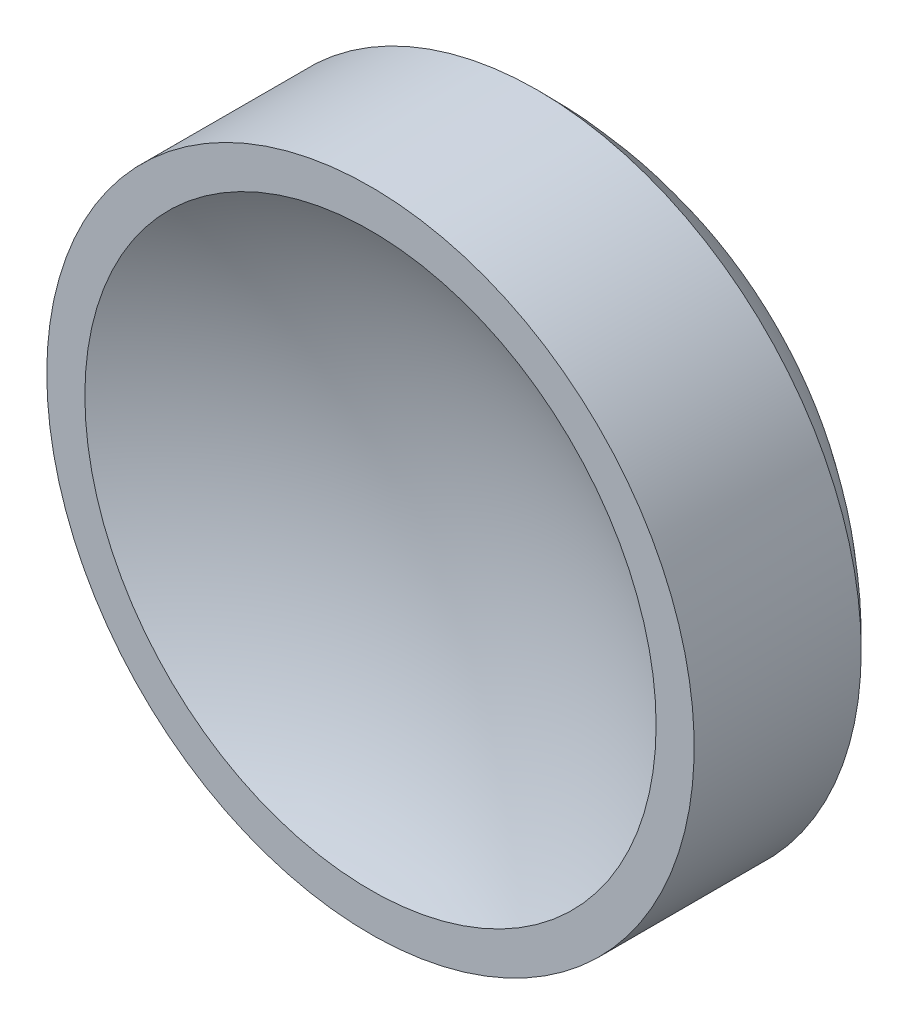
SolidWorks part; units mm, degrees
ref_plane "Front Plane" through (0, 0, 0) normal (0, 0, 1) x (1, 0, 0)
ref_plane "Top Plane" through (0, 0, 0) normal (0, 1, 0) x (1, 0, 0)
ref_plane "Right Plane" through (0, 0, 0) normal (1, 0, 0) x (0, 0, -1)
sketch "Sketch1" plane through (0, 0, 0) normal (0, 0, 1) x (1, 0, 0)
  circle A0 centre (0, 0) radius 8.5
  dimension "D1" = 17
extrude "Boss-Extrude1" add sketch "Sketch1" along normal blind 5.1745
sketch "Sketch2" plane through (0, 0, 0) normal (0, 1, 0) x (1, 0, 0)
  line L0 (8.5, 0) -> (-8.5, 0) construction
  line L1 (8, 0) -> (0, 0)
  line L2 (0, 0) -> (0, 3.132)
  arc A0 (-8, 0) -> (8, 0) centre (0, -8.651) cw construction
  arc A1 (0, 3.132) -> (8, 0) centre (0, -8.651) cw
  dimension "D1" = 11.783
  dimension "D2" = 16
revolve "Revolve1" add sketch "Sketch2" angle 360 about L2
sketch "Sketch3" plane through (0, 0, 0) normal (0, 1, 0) x (1, 0, 0)
  line L0 (8, -5.1745) -> (0, -5.1745)
  line L1 (-8.5, -5.1745) -> (8.5, -5.1745) construction
  line L2 (0, -5.1745) -> (0, -2.889)
  arc A0 (-8, -5.1745) -> (8, -5.1745) centre (0, -18.033) cw construction
  arc A1 (0, -2.889) -> (8, -5.1745) centre (0, -18.033) cw
  dimension "D1" = 15.144
  dimension "D2" = 16
revolve "Cut-Revolve1" cut sketch "Sketch3" angle 360 about L2
ref_plane "Plane1" through (0, 0, -3.132) normal (0, 0, -1) x (-1, 0, 0)
ref_plane "Plane2" through (0, 0, 2.889) normal (0, 0, 1) x (1, 0, 0)
sketch "Sketch4" plane through (0, 0, 0) normal (0, 1, 0) x (1, 0, 0)
  line L0 (0, 0) -> (0, -50000) construction
  line L2 (-8.5, -5.1745) -> (8.5, -5.1745) construction
  line L3 (-8, -5.1745) -> (8, -5.1745) construction
  line L4 (-8.5, -5.1745) -> (-7.5, -5.1745)
  line L5 (-8.5, -5.1745) -> (-8.5, -4.8766)
  line L6 (-8.5, -4.8766) -> (-7.5, -4.8766)
  line L7 (-7.5, -5.1745) -> (-7.5, -4.8766)
  line L8 (-8, 0) -> (-8.5, 0)
  line L9 (8.5, 0) -> (-8.5, 0) construction
  line L10 (8, 0) -> (-8, 0) construction
  line L11 (-8.5, 0) -> (-8.5, -0.4907)
  arc A0 (-8, -5.1745) -> (8, -5.1745) centre (0, -18.033) cw construction
  arc A1 (-8.5, -0.4907) -> (-8, 0) centre (0, -8.651) cw
  dimension "D2" = 15.144
  dimension "D1" = 16
  dimension "D3" = 7.5
  dimension "D4" = 8.5
revolve "Cut-Revolve2" cut sketch "Sketch4" angle 360 about L0
